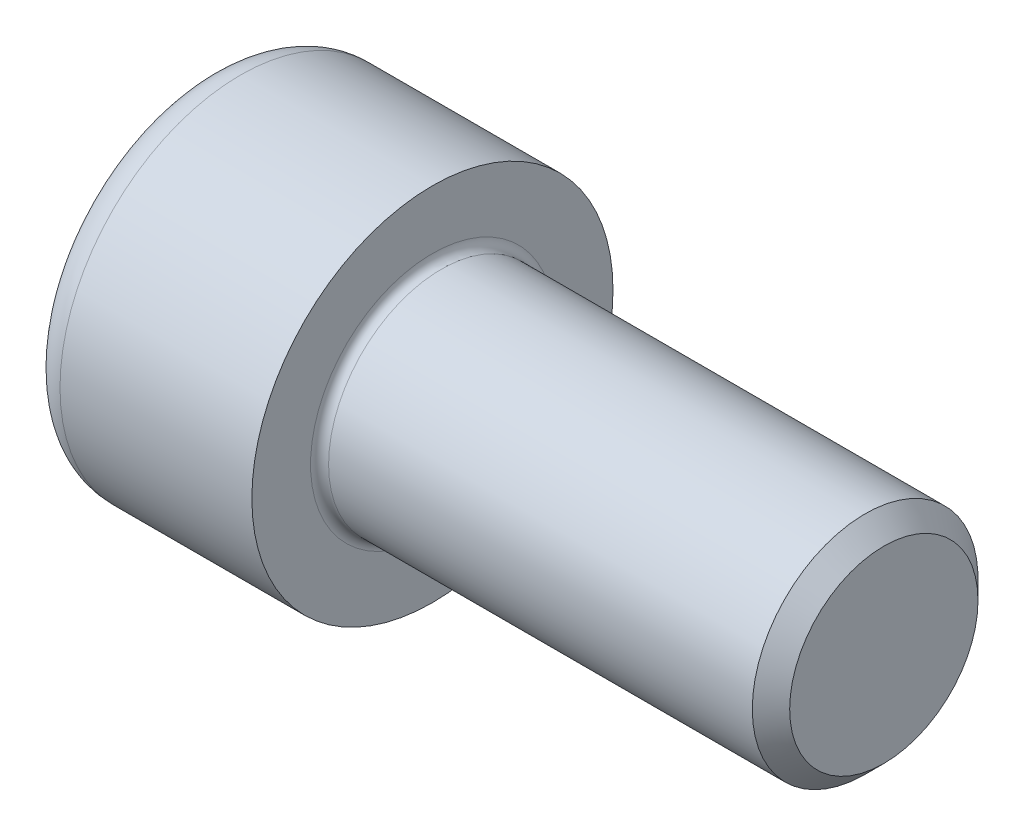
SolidWorks part; units mm, degrees
ref_plane "Plane1" through (0, 0, 0) normal (0, 0, 1) x (1, 0, 0)
ref_plane "Plane2" through (0, 0, 0) normal (0, 1, 0) x (1, 0, 0)
ref_plane "Plane3" through (0, 0, 0) normal (1, 0, 0) x (0, 0, -1)
sketch "BodySke" plane through (0, 0, 0) normal (0, 0, 1) x (1, 0, 0)
  line L0 (0, 0) -> (0, 8)
  line L1 (0, 8) -> (10, 8)
  line L2 (10, 8) -> (10, 5)
  line L3 (10, 5) -> (29.172, 5)
  line L4 (30, 4.172) -> (30, 0)
  line L5 (30, 0) -> (0, 0)
  line L6 (-31.75, 0) -> (127, 0) construction
  line L8 (30, 4.172) -> (29.172, 5)
  line L10 (30, -4.172) -> (29.172, -5) construction
  line L11 (11.5, 9.525) -> (11.5, 3.175) construction
  line L12 (10, 9.525) -> (10, 3.175) construction
  line L13 (-30, 9.525) -> (-30, 3.175) construction
  dimension "Diameter" = 10
  dimension "Head_ht" = 10
  dimension "Length" = 20
  dimension "Body_ch_ang" = 45
  dimension "Head_dia" = 16
  dimension "Minor_dia" = 8.344
  dimension "Advance" = 1.5
  dimension "Thread_nom" = 20
  dimension "Thread_length" = 60
revolve "Base-Revolve" add sketch "BodySke"
fillet "Fillet1" radius 0.4 1 edges at (10, 0, 5)
fillet "Fillet2" radius 1.5 1 edges at (0, 0, 8)
sketch "Sketch2" plane through (0, 0, 0) normal (0, 0, 1) x (1, 0, 0)
  line L0 (0, 4.0575) -> (5, 4.0575)
  line L1 (5, 4.0575) -> (7.3426, 0)
  line L2 (-31.75, 0) -> (127, 0) construction
  line L3 (7.3426, 0) -> (0, 0)
  line L4 (0, 0) -> (0, 4.0575)
  line L6 (0, 0) -> (47.625, 0) construction
  dimension "D1" = 4.0575
  dimension "D2" = 60
  dimension "Depth" = 5
revolve "Hex-PreBroach" cut sketch "Sketch2" angle 360 about L6
sketch "Sketch3" plane through (0, 0, 0) normal (-1, 0, 0) x (0, 0.5, 0.866)
  line L0 (2.3426, 4.0575) -> (-2.3426, 4.0575)
  line L1 (-2.3426, 4.0575) -> (-4.6852, 0)
  line L2 (2.3426, 4.0575) -> (4.6852, 0)
  line L3 (2.3426, -4.0575) -> (4.6852, 0)
  line L4 (2.3426, -4.0575) -> (-2.3426, -4.0575)
  line L5 (-2.3426, -4.0575) -> (-4.6852, 0)
  dimension "D1" = 4.0575
  dimension "D2" = 4.0575
  dimension "Hex_size" = 8.115
extrude "Hex" cut sketch "Sketch3" against normal blind 5
sketch "ThdSchSke" plane through (0, 0, 0) normal (0, 0, 1) x (1, 0, 0)
  line L0 (14.5, -4.172) -> (13.9202, -5)
  line L1 (14.5, -4.172) -> (15.0798, -5)
  line L2 (15.0798, -5) -> (15.0798, -6.25)
  line L3 (-3.175, 0) -> (5.1513, 0) construction
  line L4 (0, 6.5) -> (0, -6.5) construction
  line L5 (15.0798, -6.25) -> (13.9202, -6.25)
  line L6 (13.9202, -6.25) -> (13.9202, -5)
  dimension "Thread_minor" = 8.344
  dimension "Diameter" = 10
  dimension "Start" = 14.5
  dimension "SideAngle" = 55
  dimension "VeeAngle" = 70
  dimension "Overcut" = 12.5
revolve "ThreadSchematic" [suppressed] cut sketch "ThdSchSke" angle 360 about L3
pattern_linear "ThdSchPat" [suppressed]
equation "\"D2@Sketch3\" = \"Hex_size@Sketch3\" / 2"
equation "\"D1@Sketch3\" = \"Hex_size@Sketch3\" / 2"
equation "\"D1@Sketch2\" = \"Hex_size@Sketch3\" / 2"
equation "\"Thread_minor@ThreadCosmetic\"  =  \"Minor_dia@BodySke\""
equation "\"Depth@Sketch2\" =  \"Key_eng@Hex\""
equation "\"Thread_length@ThreadCosmetic\" = ((sgn( (\"Length@BodySke\" - \"Advance@BodySke\" * 3.0) - \"Thread_nom@BodySke\" )-1)*( (\"Length@BodySke\" - \"Advance@BodySke\" * 3.0) - \"Thread_nom@BodySke\" ))/-2+ \"Thread_no"
equation "\"Thread_minor@ThdSchSke\" = \"Minor_dia@BodySke\""
equation "\"Diameter@ThdSchSke\" = \"Diameter@BodySke\""
equation "\"Overcut@ThdSchSke\" = \"Diameter@BodySke\" * 1.25"
equation "\"Start@ThdSchSke\" = \"Head_ht@BodySke\" + \"Length@BodySke\" - \"Thread_length@ThreadCosmetic\"  '---Non-countersunk---"
equation "\"Num_threads@ThdSchPat\" = int( \"Thread_length@ThreadCosmetic\" / \"Advance@BodySke\" + 0.999 )  + 1"
equation "\"Advance@ThdSchPat\" = \"Thread_length@ThreadCosmetic\" /  (\"Num_threads@ThdSchPat\" - 1) 'relax it"
equation "\"Num_threads@ThdSchPat\" = \"Num_threads@ThdSchPat\" - sgn( \"Num_threads@ThdSchPat\" - 1) '---chamfered tips only---"
